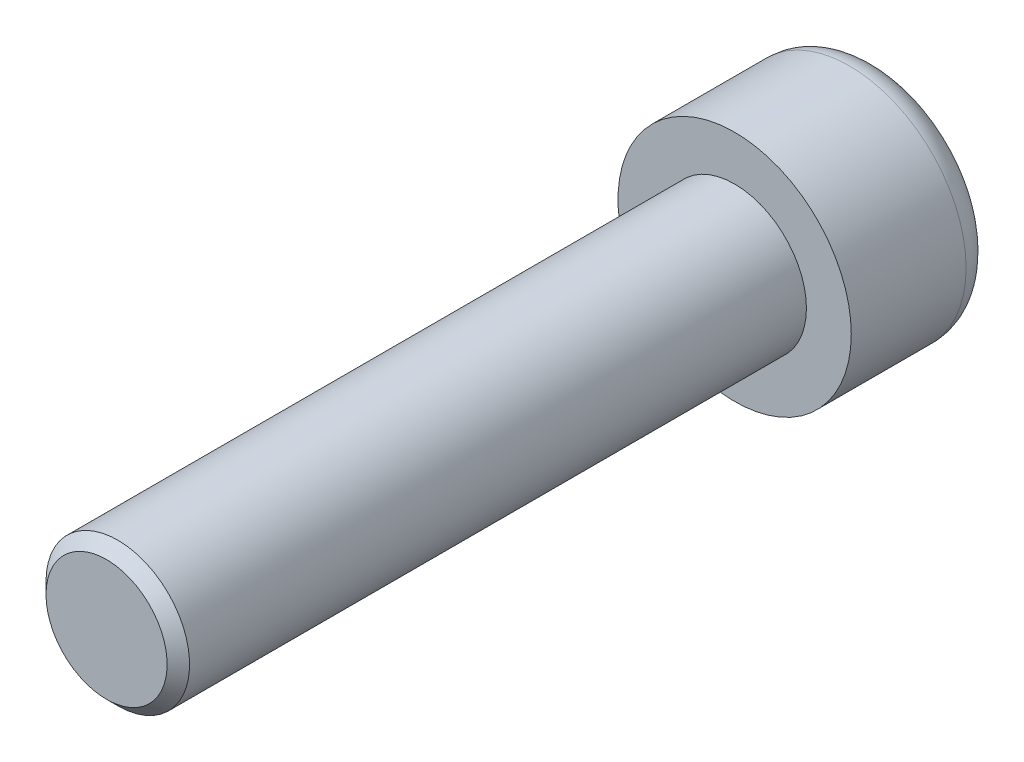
SolidWorks part; units mm, degrees
ref_plane "Plan1" through (0, 0, 0) normal (0, 0, 1) x (1, 0, 0)
ref_plane "Plan2" through (0, 0, 0) normal (0, 1, 0) x (1, 0, 0)
ref_plane "Plan3" through (0, 0, 0) normal (1, 0, 0) x (0, 0, -1)
sketch "profil tête" plane through (0, 0, 0) normal (0, 0, 1) x (1, 0, 0)
  circle A0 centre (0, 0) radius 6.5
  dimension "DIAMETRE" = 13
extrude "TETE" add sketch "profil tête" along normal blind 8
sketch "profil six pans" plane through (0, 0, 0) normal (0, 0, -1) x (-1, 0, 0)
  line L0 (0, 3.4641) -> (0, -3.4641) construction
  line L1 (0, 3.4641) -> (-3, 1.7321)
  line L2 (0, 3.4641) -> (3, 1.7321)
  line L3 (-3, 1.7321) -> (-3, -1.7321)
  line L4 (3, 1.7321) -> (3, -1.7321)
  line L5 (-3, -1.7321) -> (0, -3.4641)
  line L6 (3, -1.7321) -> (0, -3.4641)
  line L7 (-3, 1.7321) -> (3, -1.7321) construction
  line L8 (-3, -1.7321) -> (3, 1.7321) construction
  dimension "D1" = 60
  dimension "LARGEUR" = 6
extrude "SIX PANS" cut sketch "profil six pans" against normal blind 5
fillet "CONGE" radius 1.6 1 edges at (6.5, 0, 0)
sketch "profil cylindre" plane through (0, 0, 8) normal (0, 0, 1) x (1, 0, 0)
  circle A0 centre (0, 0) radius 4
  dimension "DIAMETRE" = 8
extrude "CYLINDRE FILETE" add sketch "profil cylindre" along normal blind 35
sketch "profil chanfrein" plane through (0, 0, 0) normal (1, 0, 0) x (0, 0, -1)
  line L0 (-43, 3.375) -> (-42.375, 4)
  line L1 (-43, 4) -> (-43, -4) construction
  line L2 (-43, 4) -> (-42.375, 4)
  line L3 (-8, 4) -> (-43, 4) construction
  line L4 (-12.0874, 0) -> (-18.1046, 0) construction
  line L5 (-43, 0) -> (-8, 0) construction
  line L8 (-43, 4) -> (-43, 3.375)
  dimension "D1" = 45
  dimension "D2" = 6.75
revolve "CHANFREIN FILET" cut sketch "profil chanfrein" angle 360 about L4
equation "\"D2@profil chanfrein\" = \"DIAMETRE FOND FILET@Représentation de filetage1\""
equation "\"HAUTEUR@TETE\"=\"DIAMETRE@profil cylindre\""
equation "\"PROFONDEUR@SIX PANS\" = \"HAUTEUR@TETE\" * 0.625"
equation "\"RAYON@CONGE\"=\"HAUTEUR@TETE\"/5"
